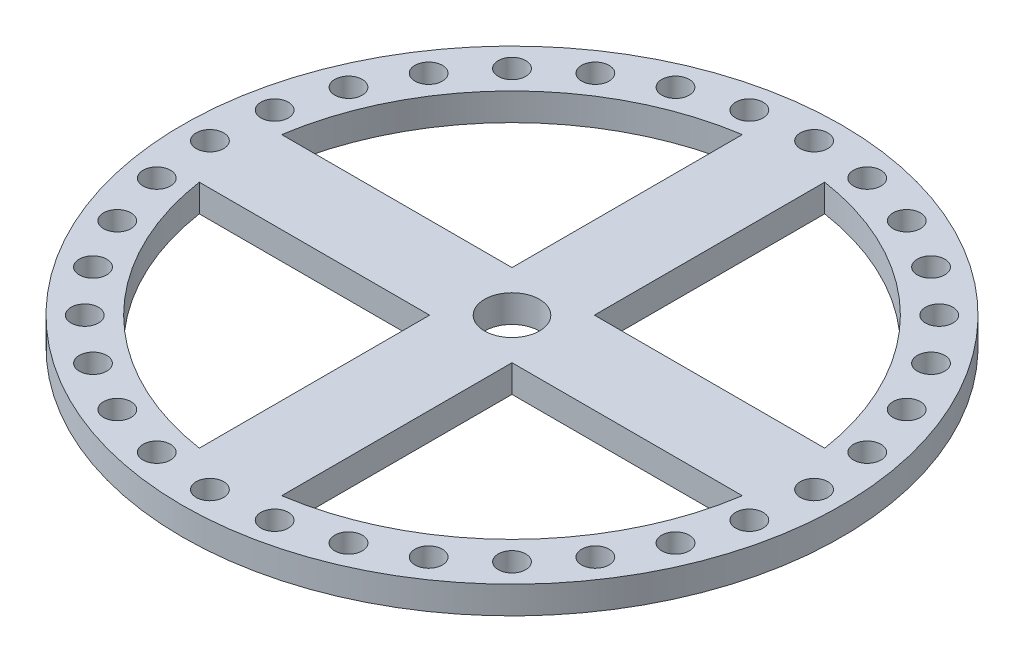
SolidWorks part; units mm, degrees
ref_plane "Front Plane" through (0, 0, 0) normal (0, 0, 1) x (1, 0, 0)
ref_plane "Top Plane" through (0, 0, 0) normal (0, 1, 0) x (1, 0, 0)
ref_plane "Right Plane" through (0, 0, 0) normal (1, 0, 0) x (0, 0, -1)
sketch "Sketch3" plane through (0, 0, 0) normal (0, 1, 0) x (1, 0, 0)
  line L2 (-7.5, -49.4343) -> (-7.5, 49.4343)
  line L4 (7.5, -49.4343) -> (7.5, 49.4343)
  line L5 (-7.5, -49.4343) -> (7.5, 49.4343) construction
  line L6 (-7.5, 49.4343) -> (7.5, -49.4343) construction
  line L7 (-49.4343, 7.5) -> (49.4343, 7.5)
  line L9 (-49.4343, -7.5) -> (49.4343, -7.5)
  line L11 (-49.4343, 7.5) -> (49.4343, -7.5) construction
  line L12 (-49.4343, -7.5) -> (49.4343, 7.5) construction
  circle A0 centre (0, 0) radius 60
  circle A1 centre (0, 0) radius 50
  circle A2 centre (0, 55) radius 2.5
  circle A3 centre (10.73, 53.9432) radius 2.5
  circle A4 centre (21.0476, 50.8134) radius 2.5
  circle A5 centre (30.5564, 45.7308) radius 2.5
  circle A6 centre (38.8909, 38.8909) radius 2.5
  circle A7 centre (45.7308, 30.5564) radius 2.5
  circle A8 centre (50.8134, 21.0476) radius 2.5
  circle A9 centre (53.9432, 10.73) radius 2.5
  circle A10 centre (55, 0) radius 2.5
  circle A11 centre (53.9432, -10.73) radius 2.5
  circle A12 centre (50.8134, -21.0476) radius 2.5
  circle A13 centre (45.7308, -30.5564) radius 2.5
  circle A14 centre (38.8909, -38.8909) radius 2.5
  circle A15 centre (30.5564, -45.7308) radius 2.5
  circle A16 centre (21.0476, -50.8134) radius 2.5
  circle A17 centre (10.73, -53.9432) radius 2.5
  circle A18 centre (0, -55) radius 2.5
  circle A19 centre (-10.73, -53.9432) radius 2.5
  circle A20 centre (-21.0476, -50.8134) radius 2.5
  circle A21 centre (-30.5564, -45.7308) radius 2.5
  circle A22 centre (-38.8909, -38.8909) radius 2.5
  circle A23 centre (-45.7308, -30.5564) radius 2.5
  circle A24 centre (-50.8134, -21.0476) radius 2.5
  circle A25 centre (-53.9432, -10.73) radius 2.5
  circle A26 centre (-55, 0) radius 2.5
  circle A27 centre (-53.9432, 10.73) radius 2.5
  circle A28 centre (-50.8134, 21.0476) radius 2.5
  circle A29 centre (-45.7308, 30.5564) radius 2.5
  circle A30 centre (-38.8909, 38.8909) radius 2.5
  circle A31 centre (-30.5564, 45.7308) radius 2.5
  circle A32 centre (-21.0476, 50.8134) radius 2.5
  circle A33 centre (-10.73, 53.9432) radius 2.5
  circle A34 centre (0, 0) radius 5
  point P71 (0, 0)
  point P78 (0, 0)
  point P79 (0, 0)
  point P80 (0, 0)
  point P81 (0, 0)
  point P82 (0, 0)
  point P83 (49.03, 9.801)
  point P84 (49.4343, -7.5)
  point P85 (-49.4343, -7.5)
  point P86 (-49.4343, 7.5)
  point P87 (7.5, -49.4343)
  dimension "D1" = 120
  dimension "D2" = 100
  dimension "D3" = 5
  dimension "D4" = 55
  dimension "D7" = 10
  dimension "D6" = 15
  dimension "D5" = 32
extrude "Boss-Extrude3" add sketch "Sketch3" along normal blind 5 contours L2 A1 L4 L9 | L7 A1 L9 L2 | L4 A1 L2 L7 | L9 A1 L7 L4 | A0 A33 A32 A31 A30 A29 A28 A27 A26 A25 A24 A23 A22 A21 A20 A19 A18 A17 A16 A15 A14 A13 A12 A11 A10 A9 | L2 L9 L4 L7 A34
